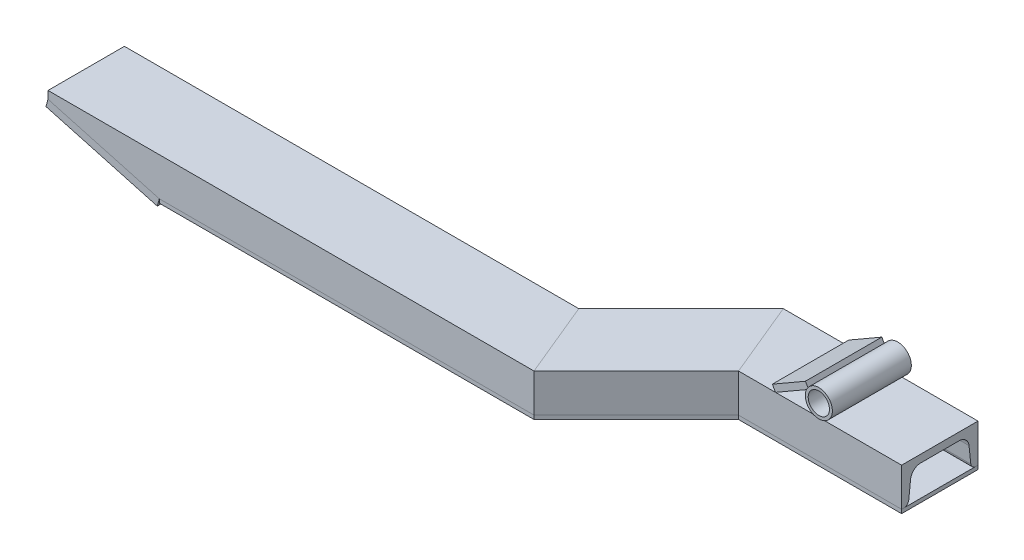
SolidWorks part; units mm, degrees
ref_plane "Plan de face" through (0, 0, 0) normal (0, 0, 1) x (1, 0, 0)
ref_plane "Plan de dessus" through (0, 0, 0) normal (0, 1, 0) x (1, 0, 0)
ref_plane "Plan de droite" through (0, 0, 0) normal (1, 0, 0) x (0, 0, -1)
sketch "Esquisse1" plane through (0, 0, 0) normal (0, 1, 0) x (1, 0, 0)
  line L0 (0, 0) -> (0, -60)
  line L1 (0, -60) -> (-128, -60)
  line L2 (-128, -60) -> (-208.3, -140.3)
  line L3 (-208.3, -140.3) -> (-502.6, -140.3)
  line L4 (-502.6, -140.3) -> (-502.6, -80.3)
  line L5 (-502.6, -80.3) -> (-233.2, -80.3)
  line L6 (-233.2, -80.3) -> (-152.9, 0)
  line L7 (-152.9, 0) -> (0, 0)
  dimension "D1" = 502.6
  dimension "D2" = 294.3
  dimension "D3" = 269.4
  dimension "D4" = 152.9
  dimension "D5" = 128
  dimension "D6" = 60
  dimension "D7" = 80.3
extrude "Extrusion1" add sketch "Esquisse1" along normal blind 3
sketch "Esquisse2" [suppressed] plane through (0, 0, 0) normal (0, -1, 0) x (1, 0, 0)
  line L0 (0, 0) -> (-152.9, 0)
  line L1 (-152.9, 0) -> (-233.2, 80.3)
  line L2 (-233.2, 80.3) -> (-590, 80.3)
  dimension "D1" = 590
other "Elément mécano-soudé1"
ref_plane "Plan1" through (0, 0, 0) normal (-1, 0, 0) x (0, 0, 1)
sketch "Sketch1" plane through (0, -30, 60) normal (-1, 0, 0) x (0, 1, 0)
  line L0 (30, 60) -> (0, 60)
  line L1 (30, 0) -> (0, 0)
  line L2 (0, 60) -> (0, 0)
  line L3 (14, 45) -> (14, 15) construction
  line L4 (0, 30) -> (14, 30) construction
  line L6 (30, 60) -> (30, 58.3274)
  line L7 (30, 0) -> (30, 1.6726)
  line L12 (6, 45) -> (6, 15)
  line L17 (13.1638, 52.9562) -> (26.4181, 54.3493)
  line L18 (13.1638, 7.0438) -> (26.4181, 5.6507)
  arc A0 (26.4181, 54.3493) -> (30, 58.3274) centre (26, 58.3274) ccw
  arc A1 (26.4181, 5.6507) -> (30, 1.6726) centre (26, 1.6726) cw
  arc A9 (6, 15) -> (13.1638, 7.0438) centre (14, 15) ccw
  arc A10 (6, 45) -> (13.1638, 52.9562) centre (14, 45) cw
  point P8 (0, 30)
  point P9 (6, 30)
  point P10 (15, 60)
  point P11 (15, 0)
  point P12 (30, 5.2743)
  point P13 (30, 54.7257)
  point P16 (0, 0)
  dimension "D4" = 4
  dimension "RI" = 8
  dimension "D2" = 6
  dimension "Depth" = 60
  dimension "BF" = 30
  dimension "TW" = 6
  dimension "d1" = 30
sketch "Esquisse4" [suppressed] plane through (0, 0, 140.3) normal (0, 0, 1) x (1, 0, 0)
  line L0 (-590, -24) -> (-502.6, 0)
  line L1 (-502.6, 0) -> (-590, 0)
  line L2 (-590, 0) -> (-590, -24)
extrude "Enlèv. mat.-Extru.1" [suppressed] cut sketch "Esquisse4" against normal through all
sketch "Esquisse5" [suppressed] plane through (-35.2412, 128.3365, 0) normal (-0.2648, 0.9643, 0) x (-0.9643, -0.2648, 0)
  line L0 (575.2945, 80.3) -> (484.6592, 80.3)
other "Elément mécano-soudé2"
ref_plane "Plan2" through (-590, -24, 80.3) normal (0.9643, 0.2648, 0) x (0, 0, -1)
sketch "Esquisse11" plane through (-590.7944, -21.1071, 110.3) normal (0.9643, 0.2648, 0) x (0, 0, -1)
  line L0 (0, 3) -> (0, -3) construction
  line L1 (-30, 3) -> (30, 3)
  line L2 (-30, 3) -> (-30, -3)
  line L3 (-30, -3) -> (30, -3)
  line L4 (30, 3) -> (30, -3)
  line L5 (-30, 0) -> (30, 0) construction
  point P9 (0, 0)
  dimension "D1" = 60
  dimension "D2" = 6
sketch "Esquisse12" plane through (0, 3, 0) normal (0, 1, 0) x (-1, 0, 0)
  line L0 (0, 0) -> (152.9, 0)
  line L1 (152.9, 0) -> (233.2, 80.3)
  line L2 (233.2, 80.3) -> (590, 80.3)
  dimension "D1" = 590
other "Elément mécano-soudé3"
ref_plane "Plan3" through (0, 3, 0) normal (-1, 0, 0) x (0, 0, 1)
sketch "Sketch11" plane through (0, 33, 0) normal (-1, 0, 0) x (0, -1, 0)
  line L0 (30, 60) -> (0, 60)
  line L1 (30, 0) -> (0, 0)
  line L2 (0, 60) -> (0, 0)
  line L3 (14, 45) -> (14, 15) construction
  line L4 (0, 30) -> (14, 30) construction
  line L6 (30, 60) -> (30, 58.3274)
  line L7 (30, 0) -> (30, 1.6726)
  line L12 (6, 45) -> (6, 15)
  line L17 (13.1638, 52.9562) -> (26.4181, 54.3493)
  line L18 (13.1638, 7.0438) -> (26.4181, 5.6507)
  arc A0 (26.4181, 54.3493) -> (30, 58.3274) centre (26, 58.3274) ccw
  arc A1 (26.4181, 5.6507) -> (30, 1.6726) centre (26, 1.6726) cw
  arc A9 (6, 15) -> (13.1638, 7.0438) centre (14, 15) ccw
  arc A10 (6, 45) -> (13.1638, 52.9562) centre (14, 45) cw
  point P8 (0, 30)
  point P9 (6, 30)
  point P10 (15, 60)
  point P11 (15, 0)
  point P12 (30, 5.2743)
  point P13 (30, 54.7257)
  point P16 (0, 0)
  dimension "D4" = 4
  dimension "RI" = 8
  dimension "D2" = 6
  dimension "Depth" = 60
  dimension "BF" = 30
  dimension "TW" = 6
  dimension "d1" = 30
sketch "Esquisse14" plane through (0, 0, 140.3) normal (0, 0, 1) x (1, 0, 0)
  line L0 (-502.6, 3) -> (-590, 27)
  line L1 (-590, 27) -> (-590, 3)
  line L2 (-590, 3) -> (-502.6, 3)
extrude "Enlèv. mat.-Extru.2" cut sketch "Esquisse14" against normal through all
sketch "Esquisse15" plane through (-34.4751, -125.5469, 0) normal (-0.2648, -0.9643, 0) x (0.9643, -0.2648, 0)
  line L0 (-576.0889, 140.3) -> (-485.4536, 140.3)
other "Elément mécano-soudé4"
ref_plane "Plan4" through (-590, 27, 140.3) normal (0.9643, -0.2648, 0) x (0, 0, -1)
sketch "Esquisse17" plane through (-590.7944, 24.1071, 110.3) normal (0.9643, -0.2648, 0) x (0, 0, -1)
  line L0 (0, 3) -> (0, -3) construction
  line L1 (-30, 3) -> (30, 3)
  line L2 (-30, 3) -> (-30, -3)
  line L3 (-30, -3) -> (30, -3)
  line L4 (30, 3) -> (30, -3)
  line L5 (-30, 0) -> (30, 0) construction
  point P9 (0, 0)
  dimension "D1" = 60
  dimension "D2" = 6
sketch "Esquisse18" plane through (0, 33, 0) normal (0, 1, 0) x (-1, 0, 0)
  line L0 (64, -1) -> (64, 61)
  line L3 (0, 60) -> (0, 0) construction
  line L4 (152.9, 0) -> (0, 0) construction
  line L5 (128.0472, 60) -> (0, 60) construction
  dimension "D1" = 64
  dimension "D2" = 1
  dimension "D3" = 1
other "Elément mécano-soudé5"
ref_plane "Plan5" through (-64, 33, -1) normal (0, 0, 1) x (1, 0, 0)
sketch "Esquisse19" plane through (-64, 43.65, -1) normal (0, 0, 1) x (1, 0, 0)
  line L0 (-10.65, 0) -> (10.65, 0) construction
  line L1 (0, 10.65) -> (0, -10.65) construction
  circle A0 centre (0, 0) radius 10.65
  circle A1 centre (0, 0) radius 8.35
  point P8 (0, 0)
  dimension "D1" = 16.7
  dimension "D2" = 21.3
sketch "Esquisse20" plane through (0, 33, 0) normal (0, 1, 0) x (-1, 0, 0)
  line L0 (99, 0) -> (99, 60)
  line L1 (152.9, 0) -> (0, 0) construction
  line L2 (128.0472, 60) -> (0, 60) construction
  line L3 (0, 60) -> (0, 0) construction
  dimension "D1" = 99
other "Elément mécano-soudé6"
ref_plane "Plan6" through (-99, 33, 0) normal (0, 0, 1) x (1, 0, 0)
sketch "Esquisse110" plane through (-87.2596, 42.6651, 0) normal (0, 0, 1) x (0.866, 0.5, 0)
  line L0 (0, 2.5) -> (0, -2.5) construction
  line L1 (-15, 2.5) -> (15, 2.5)
  line L2 (-15, 2.5) -> (-15, -2.5)
  line L3 (-15, -2.5) -> (15, -2.5)
  line L4 (15, 2.5) -> (15, -2.5)
  line L5 (-15, 0) -> (15, 0) construction
  point P8 (0, 0)
  dimension "D1" = 30
  dimension "D2" = 5
sketch "Esquisse111" [suppressed] plane through (0, -30, 0) normal (0, -1, 0) x (1, 0, 0)
  line L0 (-64, -1) -> (-64, 61)
  line L1 (0, 0) -> (0, 60) construction
  line L2 (-152.9, 0) -> (0, 0) construction
  line L3 (-128.0472, 60) -> (0, 60) construction
  dimension "D1" = 64
  dimension "D2" = 1
  dimension "D3" = 1
other "Elément mécano-soudé7"
ref_plane "Plan7" through (-64, -30, -1) normal (0, 0, 1) x (1, 0, 0)
sketch "Esquisse113" plane through (-64, -40.65, -1) normal (0, 0, 1) x (1, 0, 0)
  line L0 (-10.65, 0) -> (10.65, 0) construction
  line L1 (0, 10.65) -> (0, -10.65) construction
  circle A0 centre (0, 0) radius 10.65
  circle A1 centre (0, 0) radius 8.35
  point P8 (0, 0)
  dimension "D1" = 16.7
  dimension "D2" = 21.3
sketch "Esquisse114" [suppressed] plane through (0, -30, 0) normal (0, -1, 0) x (1, 0, 0)
  line L0 (-99, 0) -> (-99, 60)
  line L1 (-152.9, 0) -> (0, 0) construction
  line L2 (-128.0472, 60) -> (0, 60) construction
  line L3 (0, 0) -> (0, 60) construction
  dimension "D1" = 99
other "Elément mécano-soudé8"
ref_plane "Plan8" through (-99, -30, 0) normal (0, 0, 1) x (1, 0, 0)
sketch "Esquisse115" plane through (-87.2596, -39.6651, 0) normal (0, 0, 1) x (0.866, -0.5, 0)
  line L0 (0, 2.5) -> (0, -2.5) construction
  line L1 (-15, 2.5) -> (15, 2.5)
  line L2 (-15, 2.5) -> (-15, -2.5)
  line L3 (-15, -2.5) -> (15, -2.5)
  line L4 (15, 2.5) -> (15, -2.5)
  line L5 (-15, 0) -> (15, 0) construction
  point P8 (0, 0)
  dimension "D1" = 30
  dimension "D2" = 5
